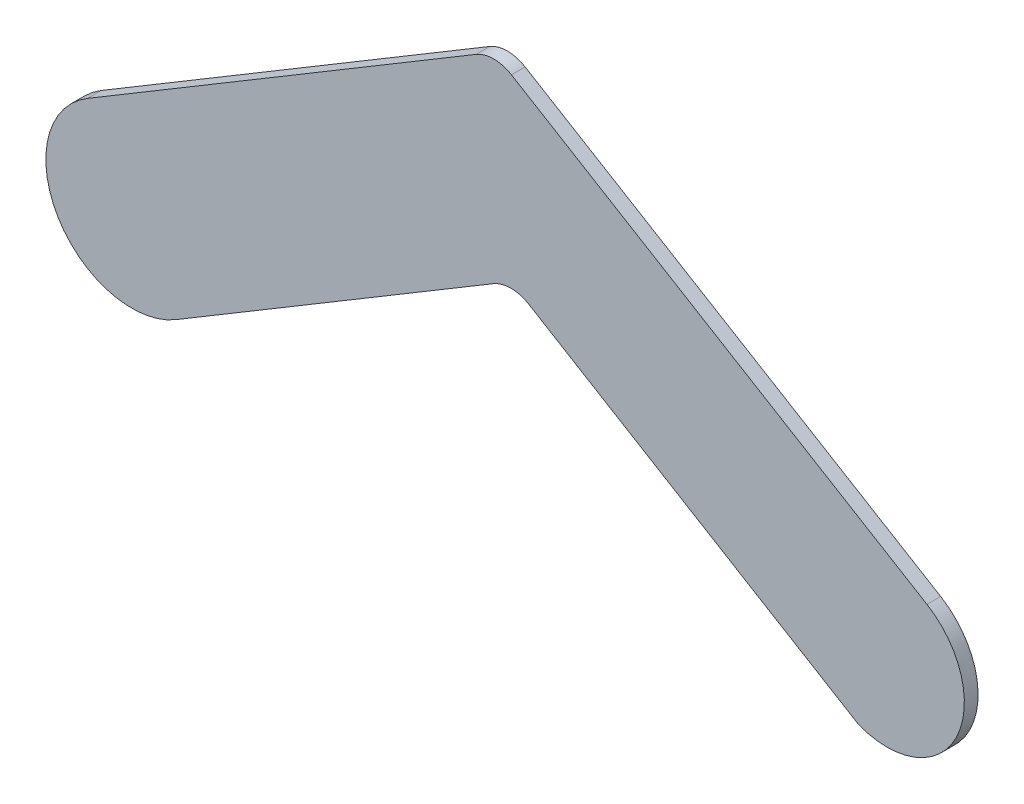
SolidWorks part; units mm, degrees
ref_plane "Ebene vorne" through (0, 0, 0) normal (0, 0, 1) x (1, 0, 0)
ref_plane "Ebene oben" through (0, 0, 0) normal (0, 1, 0) x (1, 0, 0)
ref_plane "Ebene rechts" through (0, 0, 0) normal (1, 0, 0) x (0, 0, -1)
sketch "Skizze4" plane through (0, 0, 0) normal (0, 0, 1) x (1, 0, 0)
  line L0 (2.15, 59.6033) -> (-90.4974, 4.1889)
  line L1 (-116.3224, 47.2152) -> (-2.8845, 115.0648)
  line L2 (7.4163, 115.0441) -> (128.7258, 41.8208)
  line L3 (108.7618, 1.4485) -> (12.4508, 59.5825)
  arc A0 (-116.256, 47.2549) -> (-90.4974, 4.1889) centre (-103.4099, 25.7021) ccw
  arc A1 (108.7618, 1.4485) -> (128.7258, 41.8208) centre (117.0476, 22.4735) ccw
  arc A2 (-2.8845, 115.0648) -> (7.4163, 115.0441) centre (2.2486, 106.4828) cw
  arc A3 (2.15, 59.6033) -> (12.4508, 59.5825) centre (7.2831, 51.0213) cw
  dimension "D3" = 10
  dimension "D4" = 10
  dimension "D1" = 118
  dimension "D2" = 118
extrude "Aufsatz-Linear austragen1" add sketch "Skizze4" against normal blind 4 contours L3 A1 L2 L1 A0 L0
scale "Skalieren1" scale about centroid uniform scaling yes scale factor 1.19
